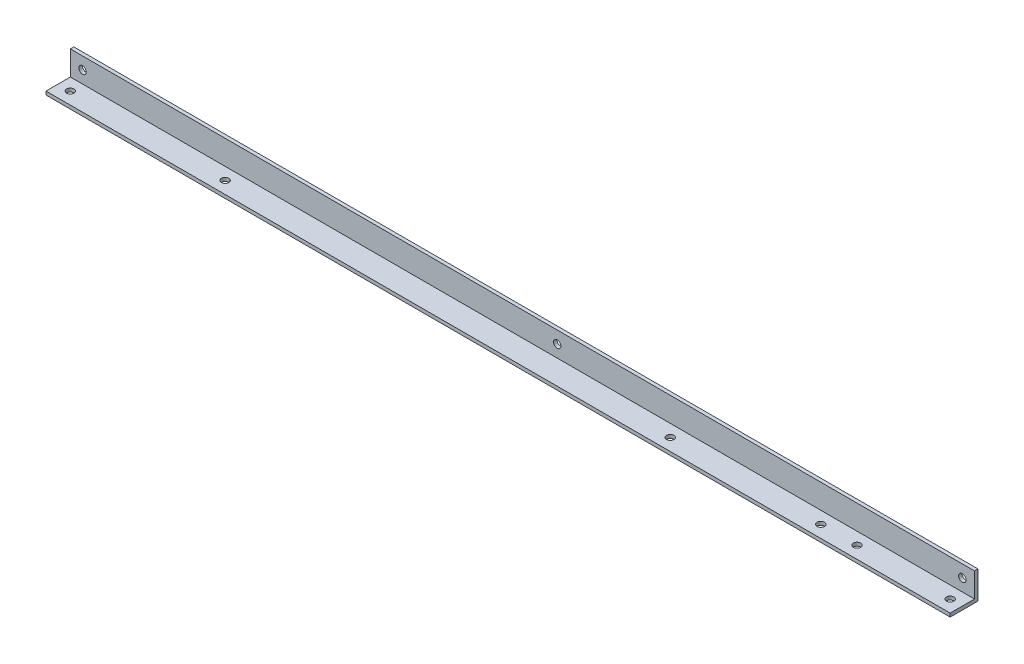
SolidWorks part; units mm, degrees
ref_plane "Front Plane" through (0, 0, 0) normal (0, 0, 1) x (1, 0, 0)
ref_plane "Top Plane" through (0, 0, 0) normal (0, 1, 0) x (1, 0, 0)
ref_plane "Right Plane" through (0, 0, 0) normal (1, 0, 0) x (0, 0, -1)
sketch "Sketch1" plane through (0, 0, 0) normal (0, 1, 0) x (1, 0, 0)
  line L1 (-412.75, 12.7) -> (412.75, 12.7)
  line L2 (-412.75, 12.7) -> (-412.75, -12.7)
  line L3 (-412.75, -12.7) -> (412.75, -12.7)
  line L4 (412.75, 12.7) -> (412.75, -12.7)
  line L5 (-412.75, 12.7) -> (412.75, -12.7) construction
  line L6 (-412.75, -12.7) -> (412.75, 12.7) construction
  point P0 (0, 0)
  dimension "D1" = 825.5
  dimension "D2" = 25.4
extrude "Boss-Extrude1" add sketch "Sketch1" along normal blind 3.175
sketch "Sketch2" plane through (0, 3.175, 0) normal (0, 1, 0) x (1, 0, 0)
  line L0 (-412.75, 12.7) -> (-412.75, 9.525)
  line L1 (-412.75, 12.7) -> (-412.75, -12.7) construction
  line L2 (-412.75, 9.525) -> (412.75, 9.525)
  line L3 (412.75, -12.7) -> (412.75, 12.7) construction
  line L4 (412.75, 9.525) -> (412.75, 12.7)
  line L5 (412.75, 12.7) -> (-412.75, 12.7)
  dimension "D1" = 3.175
extrude "Boss-Extrude2" add sketch "Sketch2" along normal blind 22.225
sketch "Sketch3" plane through (0, 3.175, 0) normal (0, 1, 0) x (1, 0, 0)
  line L0 (-412.75, -1.5875) -> (412.75, -1.5875) construction
  line L1 (-412.75, 9.525) -> (-412.75, -12.7) construction
  line L2 (412.75, -12.7) -> (412.75, 9.525) construction
  line L3 (-412.75, -12.7) -> (412.75, -12.7) construction
  circle A0 centre (-401.6375, -1.5875) radius 3.3782
  circle A1 centre (-260.35, -1.5875) radius 3.3782
  circle A2 centre (401.6375, -1.5875) radius 3.3782
  circle A3 centre (316.5475, -1.5875) radius 3.3782
  circle A4 centre (146.05, -1.5875) radius 3.3782
  circle A5 centre (283.5275, -1.5875) radius 3.3782
  dimension "D2" = 6.7564
  dimension "D3" = 6.7564
  dimension "D4" = 6.7564
  dimension "D5" = 6.7564
  dimension "D10" = 6.7564
  dimension "D12" = 6.7564
  dimension "D1" = 11.1125
  dimension "D6" = 11.1125
  dimension "D7" = 96.2025
  dimension "D8" = 11.1125
  dimension "D9" = 33.02
  dimension "D11" = 152.4
  dimension "D13" = 558.8
extrude "Cut-Extrude1" cut sketch "Sketch3" against normal through all
sketch "Sketch4" plane through (0, 0, -9.525) normal (0, 0, 1) x (1, 0, 0)
  line L0 (-412.75, 14.2875) -> (412.75, 14.2875) construction
  line L1 (-412.75, 25.4) -> (-412.75, 3.175) construction
  line L2 (412.75, 25.4) -> (412.75, 3.175) construction
  line L3 (-412.75, 25.4) -> (412.75, 25.4) construction
  circle A0 centre (-401.6375, 14.2875) radius 3.3782
  circle A1 centre (401.6375, 14.2875) radius 3.3782
  circle A2 centre (31.75, 14.2875) radius 3.3782
  dimension "D2" = 6.7564
  dimension "D4" = 6.7564
  dimension "D5" = 6.7564
  dimension "D1" = 11.1125
  dimension "D3" = 11.1125
  dimension "D6" = 11.1125
  dimension "D7" = 381
extrude "Cut-Extrude2" cut sketch "Sketch4" against normal through all
